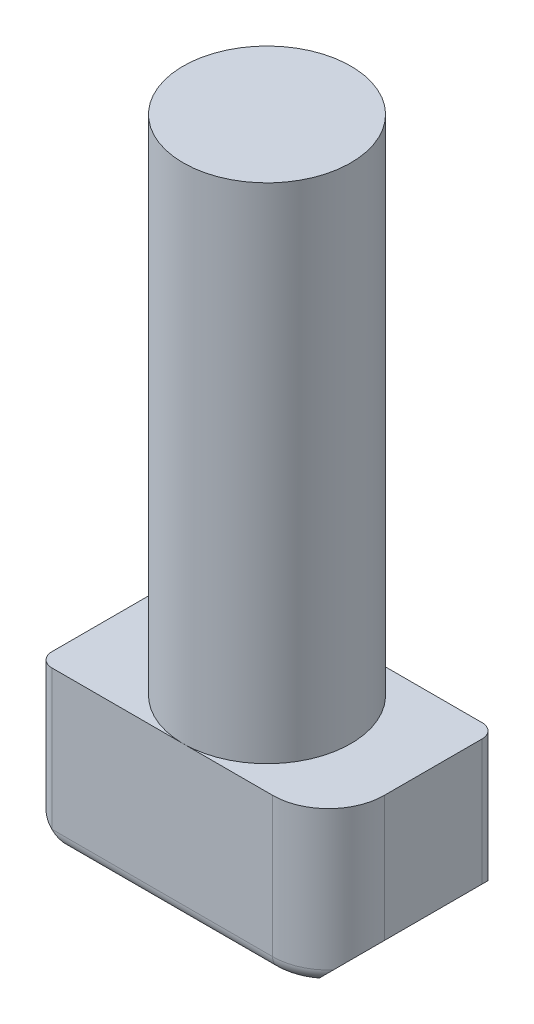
SolidWorks part; units mm, degrees
ref_plane "正面" through (0, 0, 0) normal (0, 0, 1) x (1, 0, 0)
ref_plane "平面" through (0, 0, 0) normal (0, 1, 0) x (1, 0, 0)
ref_plane "右側面" through (0, 0, 0) normal (1, 0, 0) x (0, 0, -1)
sketch "ｽｹｯﾁ2" plane through (0, 0, 0) normal (1, 0, 0) x (0, 0, -1)
  line L0 (-3, 0) -> (3, 0)
  line L1 (-3, 5.5) -> (3, 5.5)
  line L2 (-3, 5.5) -> (-3, 0)
  line L3 (3, 5.5) -> (3, 0)
extrude "ﾎﾞｽ - 押し出し1" add sketch "ｽｹｯﾁ2" along normal mid plane 10.4
chamfer "面取り1" distance 1 angle 45 2 edges at (-5.2, 0, 0) (5.2, 0, 0)
fillet "ﾌｨﾚｯﾄ2" radius 2 2 edges at (-5.2, 3.25, -3) (5.2, 3.25, 3)
fillet "ﾌｨﾚｯﾄ3" radius 0.5 8 edges at (-0.5, 0, 3) (3.7176, 0, 2.9319) (0.5, 0, -3) (-3.7176, 0, -2.9319) (-5.2, 3.25, 3) (5.2, 3.25, -3) (4.2, 0, -0.134) (-4.2, 0, 0.134)
sketch "ｽｹｯﾁ4" plane through (0, 5.5, 0) normal (0, 1, 0) x (1, 0, 0)
  circle A0 centre (0, 0) radius 3
extrude "ﾎﾞｽ - 押し出し2" add sketch "ｽｹｯﾁ4" along normal blind 18
